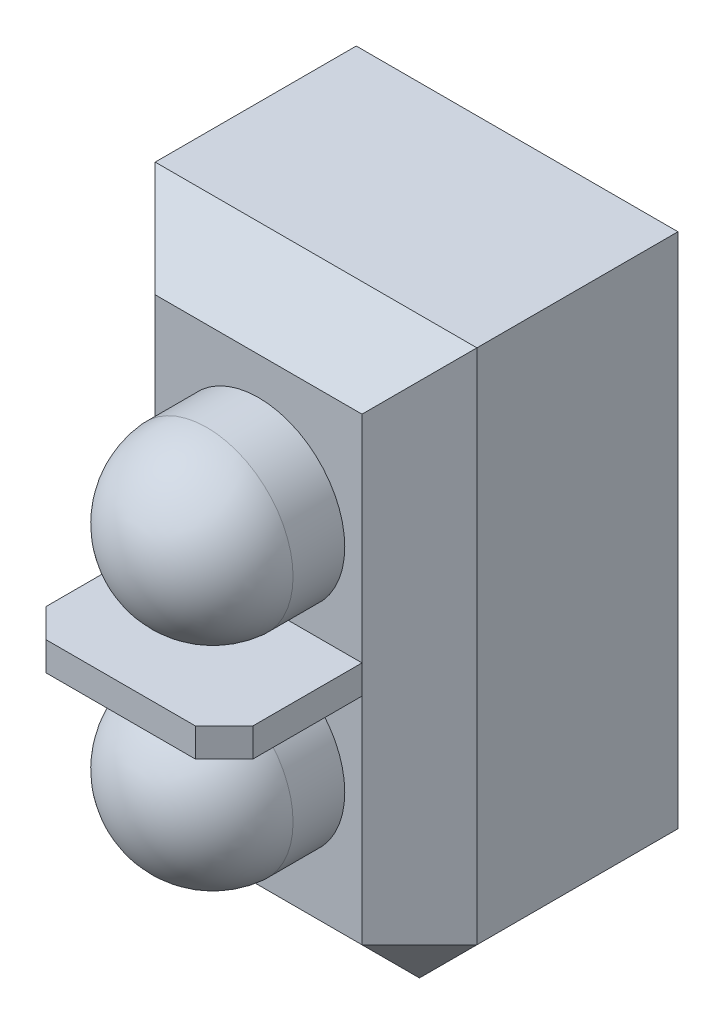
SolidWorks part; units mm, degrees
ref_plane "Front Plane" through (0, 0, 0) normal (0, 0, 1) x (1, 0, 0)
ref_plane "Top Plane" through (0, 0, 0) normal (0, 1, 0) x (1, 0, 0)
ref_plane "Right Plane" through (0, 0, 0) normal (1, 0, 0) x (0, 0, -1)
sketch "Sketch1" plane through (0, 0, 0) normal (0, 0, 1) x (1, 0, 0)
  line L1 (-2.8, 5) -> (2.8, 5)
  line L2 (-2.8, 5) -> (-2.8, -5)
  line L3 (-2.8, -5) -> (2.8, -5)
  line L4 (2.8, 5) -> (2.8, -5)
  line L5 (-2.8, 5) -> (2.8, -5) construction
  line L6 (-2.8, -5) -> (2.8, 5) construction
  point P0 (0, 0)
  dimension "D1" = 10
  dimension "D2" = 5.6
extrude "Boss-Extrude1" add sketch "Sketch1" along normal blind 4.5
chamfer "Chamfer1" distance 1 angle 45 6 edges at (2.8, -5, 2.25) (-2.8, -5, 2.25) (2.8, 0, 4.5) (0, -5, 4.5) (0, 5, 4.5) (-2.8, 0, 4.5)
sketch "Sketch2" plane through (0, 0, 4.5) normal (0, 0, 1) x (1, 0, 0)
  line L0 (0, 1.85) -> (0, -1.85) construction
  line L1 (-1.6378, 0) -> (1.752, 0) construction
  circle A0 centre (0, 1.85) radius 1.5
  circle A1 centre (0, -1.85) radius 1.5
  dimension "D2" = 3
  dimension "D3" = 3
  dimension "D1" = 3.7
extrude "Boss-Extrude2" add sketch "Sketch2" along normal blind 0.9
dome "Dome1" faces to dome 2 distance 1.4 parameters "D1"=1.4
dome "Dome2" faces to dome 2 distance 1.4 parameters "D1"=1.4
sketch "Sketch3" plane through (0, 0, 4.5) normal (0, 0, 1) x (1, 0, 0)
  line L0 (1.8, -4) -> (1.8, 4) construction
  line L1 (-1.8, -0.25) -> (1.8, -0.25)
  line L2 (-1.8, -0.25) -> (-1.8, 0.25)
  line L3 (-1.8, 0.25) -> (1.8, 0.25)
  line L4 (1.8, -0.25) -> (1.8, 0.25)
  line L5 (-1.8, -0.25) -> (1.8, 0.25) construction
  line L6 (-1.8, 0.25) -> (1.8, -0.25) construction
  point P0 (0, 0)
  dimension "D1" = 0.5
extrude "Boss-Extrude3" add sketch "Sketch3" along normal blind 2.4
chamfer "Chamfer2" distance 0.5 angle 45 2 edges at (-1.8, 0, 6.9) (1.8, 0, 6.9)
sketch "Sketch4" plane through (0, 0, 0) normal (0, 0, -1) x (-1, 0, 0)
  line L0 (0, 0) -> (-2.8, 0) construction
  line L1 (-2.8, -4) -> (-2.8, 5) construction
  line L2 (-2.8, 0) -> (2.8, 0) construction
  line L3 (2.8, 5) -> (2.8, -4) construction
  line L4 (0, 5) -> (0, -5) construction
  line L5 (-2.8, 5) -> (2.8, 5) construction
  line L6 (1.8, -5) -> (-1.8, -5) construction
  line L7 (1.075, 1.65) -> (1.075, 2.05)
  line L8 (-1.075, 1.65) -> (-0.425, 1.65)
  line L9 (-1.075, 1.65) -> (-1.075, 2.05)
  line L10 (-1.075, 2.05) -> (-0.425, 2.05)
  line L11 (-0.425, 1.65) -> (-0.425, 2.05)
  line L12 (-1.075, 1.65) -> (-0.425, 2.05) construction
  line L13 (-1.075, 2.05) -> (-0.425, 1.65) construction
  line L14 (1.075, 1.65) -> (0.425, 1.65)
  line L15 (0.425, 1.65) -> (0.425, 2.05)
  line L16 (1.075, 2.05) -> (0.425, 2.05)
  line L17 (1.075, -1.65) -> (0.425, -1.65)
  line L18 (1.075, -1.65) -> (1.075, -2.05)
  line L19 (1.075, -2.05) -> (0.425, -2.05)
  line L20 (0.425, -1.65) -> (0.425, -2.05)
  line L21 (-0.425, -1.65) -> (-0.425, -2.05)
  line L22 (-1.075, -1.65) -> (-0.425, -1.65)
  line L23 (-1.075, -1.65) -> (-1.075, -2.05)
  line L24 (-1.075, -2.05) -> (-0.425, -2.05)
  point P14 (-0.75, 1.85)
  dimension "D1" = 1.85
  dimension "D2" = 0.75
  dimension "D3" = 0.65
  dimension "D4" = 0.4
extrude "Boss-Extrude4" add sketch "Sketch4" along normal blind 1.2
